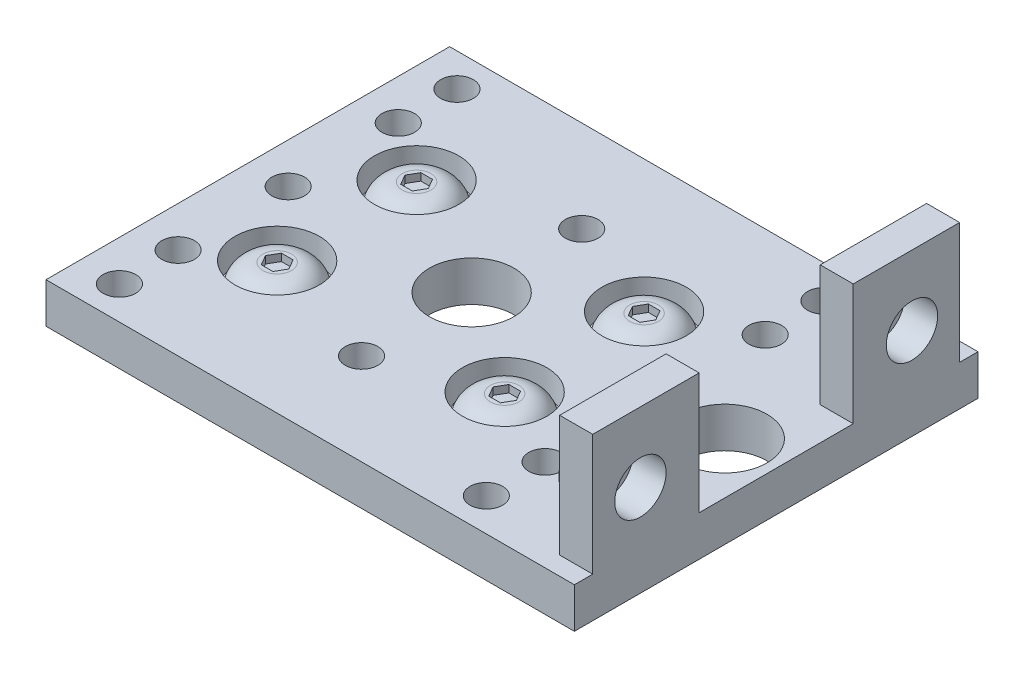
SolidWorks part; units mm, degrees
ref_plane "Front Plane" through (0, 0, 0) normal (0, 0, 1) x (1, 0, 0)
ref_plane "Top Plane" through (0, 0, 0) normal (0, 1, 0) x (1, 0, 0)
ref_plane "Right Plane" through (0, 0, 0) normal (1, 0, 0) x (0, 0, -1)
sketch "Sketch1" plane through (0, 0, 0) normal (0, 1, 0) x (1, 0, 0)
  line L1 (-18.288, -13.97) -> (18.288, -13.97)
  line L2 (-18.288, -13.97) -> (-18.288, 13.97)
  line L3 (-18.288, 13.97) -> (18.288, 13.97)
  line L4 (18.288, -13.97) -> (18.288, 13.97)
  line L5 (-18.288, -13.97) -> (18.288, 13.97) construction
  line L6 (-18.288, 13.97) -> (18.288, -13.97) construction
  point P0 (0, 0)
  dimension "D1" = 36.576
  dimension "D2" = 27.94
extrude "Base" add sketch "Sketch1" along normal blind 2.794
sketch "Sketch2" plane through (0, 0, 0) normal (0, 1, 0) x (1, 0, 0)
  line L0 (18.288, -13.97) -> (18.288, 13.97) construction
  line L1 (18.288, 12.7) -> (16.002, 12.7)
  line L2 (18.288, 12.7) -> (18.288, 5.334)
  line L3 (18.288, 5.334) -> (16.002, 5.334)
  line L4 (16.002, 12.7) -> (16.002, 5.334)
  line L5 (16.002, 5.334) -> (16.002, -5.334) construction
  line L6 (18.288, -5.334) -> (16.002, -5.334)
  line L7 (18.288, -5.334) -> (18.288, -12.7)
  line L8 (18.288, -12.7) -> (16.002, -12.7)
  line L9 (16.002, -5.334) -> (16.002, -12.7)
  line L10 (16.002, 0) -> (0, 0) construction
  line L11 (-18.288, -13.97) -> (18.288, -13.97) construction
  line L12 (-18.288, 13.97) -> (-18.288, -13.97) construction
  dimension "D1" = 19.304
  dimension "D2" = 1.27
  dimension "D3" = 34.29
extrude "Tabs" add sketch "Sketch2" along normal blind 11.176
sketch "Sketch3" plane through (18.288, 0, 0) normal (1, 0, 0) x (0, 0, -1)
  line L0 (-13.97, 0) -> (13.97, 0) construction
  line L1 (-13.97, 2.794) -> (-13.97, 0) construction
  circle A0 centre (-9.398, 6.35) radius 1.778
  circle A1 centre (9.398, 6.35) radius 1.778
  point P6 (0, 0)
  dimension "D1" = 3.556
  dimension "D2" = 6.35
  dimension "D3" = 4.572
  dimension "D4" = 23.368
extrude "Tab Holes" cut sketch "Sketch3" against normal through all
sketch "Hole Locations" plane through (0, 2.794, 0) normal (0, 1, 0) x (1, 0, 0)
  line L0 (-15.494, 11.684) -> (-15.494, -11.684) construction
  line L1 (-15.494, -11.684) -> (9.906, -11.684) construction
  line L2 (9.906, -11.684) -> (9.906, 11.684) construction
  line L3 (9.906, 11.684) -> (-15.494, 11.684) construction
  line L4 (-15.494, 7.62) -> (9.906, 7.62) construction
  line L5 (-15.494, 0) -> (9.906, 0) construction
  line L6 (-15.494, -7.62) -> (9.906, -7.62) construction
  line L7 (-2.794, -7.62) -> (-2.794, 7.62) construction
  line L8 (-18.288, 13.97) -> (-18.288, -13.97) construction
  line L9 (-18.288, -13.97) -> (18.288, -13.97) construction
  point P16 (-15.494, -6.9755)
  dimension "D1" = 2.794
  dimension "D2" = 2.286
  dimension "D3" = 6.35
  dimension "D4" = 13.97
  dimension "D5" = 21.59
  dimension "D6" = 25.654
  dimension "D7" = 15.494
  dimension "D8" = 28.194
hole_wizard "#4-40 Tapped Hole1" positions "Sketch5" profile "Sketch6" tap size "#4-40" standard "ANSI Inch"
sketch "Sketch5" plane through (0, 2.794, 0) normal (0, 1, 0) x (-1, 0, 0)
  point P0 (15.494, -11.684)
  point P3 (15.494, -7.62)
  point P6 (15.494, 0)
  point P9 (15.494, 7.62)
  point P12 (15.494, 11.684)
  point P15 (-9.906, 11.684)
  point P18 (-9.906, 7.62)
  point P21 (-9.906, 0)
  point P24 (-9.906, -7.62)
  point P27 (-9.906, -11.684)
  point P30 (2.794, -7.62)
  point P33 (2.794, 7.62)
sketch "Sketch6" plane through (-15.494, 2.794, -11.684) normal (1, 0, 0) x (0, 0, 1)
  line L0 (0, 0) -> (0, 8.2992)
  line L1 (0, 8.2992) -> (1.1303, 7.62)
  line L2 (1.1303, 7.62) -> (1.1303, 0)
  line L5 (1.1303, 0) -> (0, 0)
  line L10 (0, 8.2992) -> (-1.1303, 7.62) construction
  line L11 (0, -6.35) -> (0, 107.95) construction
  dimension "Tap Drill Dia." = 2.2606
  dimension "Tap Drill Depth" = 7.62
  dimension "Drill Angle" = 118
sketch "Sketch7" plane through (0, 2.794, 0) normal (0, 1, 0) x (1, 0, 0)
  line L0 (-18.288, -13.97) -> (18.288, -13.97) construction
  line L1 (-11.43, 4.826) -> (4.318, 4.826) construction
  line L2 (-11.43, 4.826) -> (-11.43, -4.826) construction
  line L3 (-11.43, -4.826) -> (4.318, -4.826) construction
  line L4 (4.318, 4.826) -> (4.318, -4.826) construction
  line L5 (-18.288, 13.97) -> (-18.288, -13.97) construction
  circle A0 centre (-11.43, 4.826) radius 2.921
  circle A1 centre (4.318, 4.826) radius 2.921
  circle A2 centre (4.318, -4.826) radius 2.921
  circle A3 centre (-11.43, -4.826) radius 2.921
  point P12 (-11.43, 0)
  dimension "D1" = 5.842
  dimension "D2" = 18.796
  dimension "D3" = 6.858
  dimension "D4" = 15.748
  dimension "D5" = 9.144
extrude "Counter" cut sketch "Sketch7" against normal blind 1.778
sketch "Sketch8" plane through (0, 1.016, 0) normal (0, 1, 0) x (1, 0, 0)
  circle A0 centre (-11.43, 4.826) radius 1.524
  circle A1 centre (4.318, 4.826) radius 1.524
  circle A2 centre (4.318, -4.826) radius 1.524
  circle A3 centre (-11.43, -4.826) radius 1.524
  dimension "D1" = 3.048
extrude "Thru" cut sketch "Sketch8" against normal through all
sketch "Sketch9" plane through (0, 2.794, 0) normal (0, 1, 0) x (1, 0, 0)
  line L0 (-2.794, -7.62) -> (-2.794, 0) construction
  line L1 (9.906, 0) -> (14.732, 0) construction
  line L2 (-18.288, 13.97) -> (-18.288, -13.97) construction
  circle A0 centre (14.732, 0) radius 2.921
  circle A1 centre (-2.794, 0) radius 2.921
  point P7 (0, 0)
  dimension "D1" = 5.842
  dimension "D2" = 33.02
extrude "Thru 2" cut sketch "Sketch9" against normal through all
sketch "Sketch10" plane through (0, 2.794, 0) normal (0, 1, 0) x (1, 0, 0)
  line L0 (-14.351, -4.826) -> (-8.509, -4.826) construction
  circle A0 centre (-11.43, -4.826) radius 2.921 construction
  circle A1 centre (-11.43, -4.826) radius 2.921 construction
ref_plane "Plane1" through (0, 0, 4.826) normal (0, 0, 1) x (1, 0, 0)
sketch "Sketch11" plane through (0, 0, 4.826) normal (0, 0, 1) x (1, 0, 0)
  line L0 (-11.43, 1.016) -> (-8.763, 1.016)
  line L1 (-10.4394, 2.6924) -> (-11.43, 2.6924)
  line L2 (-11.43, 2.6924) -> (-11.43, 1.016)
  line L3 (-11.43, 2.6924) -> (-11.43, 4.6347) construction
  line L4 (-14.351, 1.016) -> (-8.509, 2.794) construction
  line L9 (-11.43, 1.905) -> (-11.43, -0.7111) construction
  arc A0 (-8.763, 1.016) -> (-10.4394, 2.6924) centre (-10.4394, 1.016) ccw
  point P4 (-9.0213, 0.9118)
  point P9 (-9.0091, 0.9603)
  dimension "D1" = 1.6764
  dimension "D2" = 0.254
revolve "Screw" add sketch "Sketch11" angle 360 about L3
sketch "Sketch12" plane through (0, 2.6924, 0) normal (0, 1, 0) x (1, 0, 0)
  line L1 (-11.0267, -4.1275) -> (-11.8333, -4.1275)
  line L2 (-11.8333, -4.1275) -> (-12.2366, -4.826)
  line L3 (-12.2366, -4.826) -> (-11.8333, -5.5245)
  line L4 (-11.8333, -5.5245) -> (-11.0267, -5.5245)
  line L5 (-11.0267, -5.5245) -> (-10.6234, -4.826)
  line L6 (-10.6234, -4.826) -> (-11.0267, -4.1275)
  circle A0 centre (-11.43, -4.826) radius 0.6985 construction
  point P1 (-11.1398, -4.3234)
  dimension "D1" = 1.397
extrude "Screw Hex" cut sketch "Sketch12" against normal blind 0.508
pattern_linear "LPattern1" count 2 spacing 15.748 along (1, 0, 0) count 2 spacing 9.652 along (0, 0, -1) of "Screw", "Screw Hex"
ref_plane "Plane2" through (0, 0, 9.398) normal (0, 0, 1) x (1, 0, 0)
sketch "Sketch13" plane through (0, 0, 9.398) normal (0, 0, 1) x (1, 0, 0)
  line L0 (16.002, 4.572) -> (18.288, 8.128) construction
  line L1 (16.002, 11.176) -> (16.002, 2.794) construction
  line L2 (18.288, 11.176) -> (18.288, 2.794) construction
  line L7 (17.145, 6.35) -> (12.39, 6.35) construction
  line L8 (16.002, 6.35) -> (16.002, 3.683)
  line L9 (14.3256, 5.3594) -> (14.3256, 6.35)
  line L10 (14.3256, 6.35) -> (16.002, 6.35)
  arc A0 (16.002, 3.683) -> (14.3256, 5.3594) centre (16.002, 5.3594) cw
  point P14 (15.5719, 6.35)
  dimension "D1" = 2.667
  dimension "D2" = 1.6764
revolve "Vert Screw" add sketch "Sketch13" angle 360 about L7
sketch "Sketch14" plane through (14.3256, 0, 0) normal (-1, 0, 0) x (0, 0, 1)
  line L1 (9.398, 7.1566) -> (8.6995, 6.7533)
  line L2 (8.6995, 6.7533) -> (8.6995, 5.9467)
  line L3 (8.6995, 5.9467) -> (9.398, 5.5434)
  line L4 (9.398, 5.5434) -> (10.0965, 5.9467)
  line L5 (10.0965, 5.9467) -> (10.0965, 6.7533)
  line L6 (10.0965, 6.7533) -> (9.398, 7.1566)
  circle A0 centre (9.398, 6.35) radius 0.6985 construction
  dimension "D1" = 1.397
extrude "Vert Screw Hex" cut sketch "Sketch14" against normal blind 0.508
pattern_linear "LPattern2" count 2 spacing 18.796 along (0, 0, -1) of "Vert Screw Hex", "Vert Screw"
